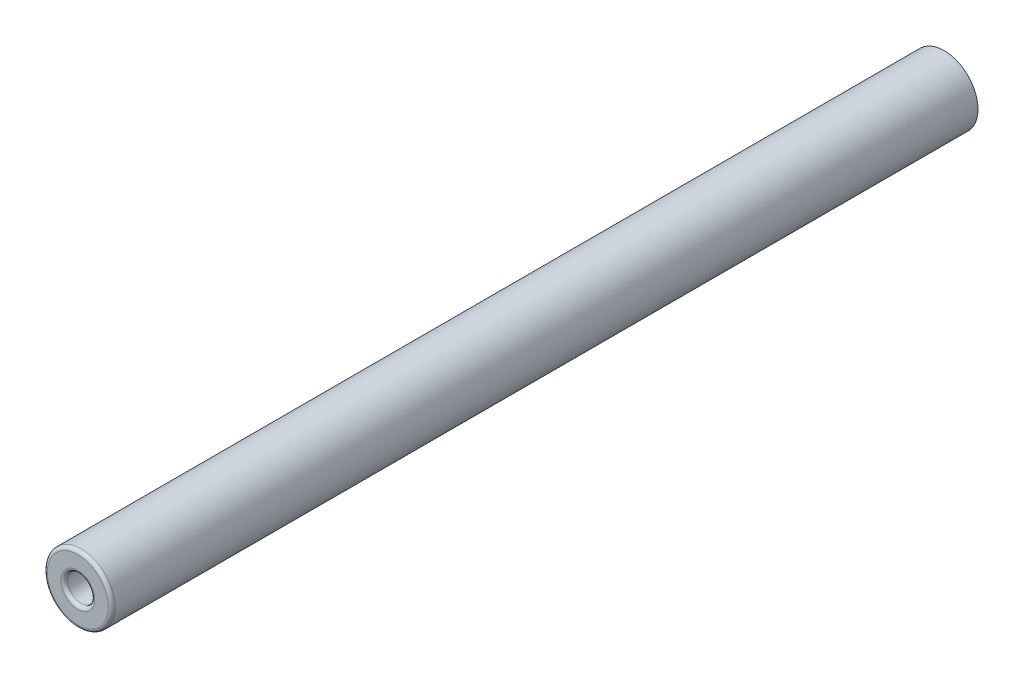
SolidWorks part; units mm, degrees
ref_plane "Front Plane" through (0, 0, 0) normal (0, 0, 1) x (1, 0, 0)
ref_plane "Top Plane" through (0, 0, 0) normal (0, 1, 0) x (1, 0, 0)
ref_plane "Right Plane" through (0, 0, 0) normal (1, 0, 0) x (0, 0, -1)
sketch "Sketch1" plane through (0, 0, 0) normal (0, 0, 1) x (1, 0, 0)
  circle A0 centre (0, 0) radius 2.5
  dimension "D1" = 5
extrude "Boss-Extrude1" add sketch "Sketch1" along normal blind 64
sketch "Sketch2" plane through (0, 0, 64) normal (0, 0, 1) x (1, 0, 0)
  circle A0 centre (0, 0) radius 1
  dimension "D1" = 2
extrude "Cut-Extrude1" cut sketch "Sketch2" against normal blind 10
fillet "Fillet1" radius 0.25 2 edges at (2.5, 0, 64) (1, 0, 64)
